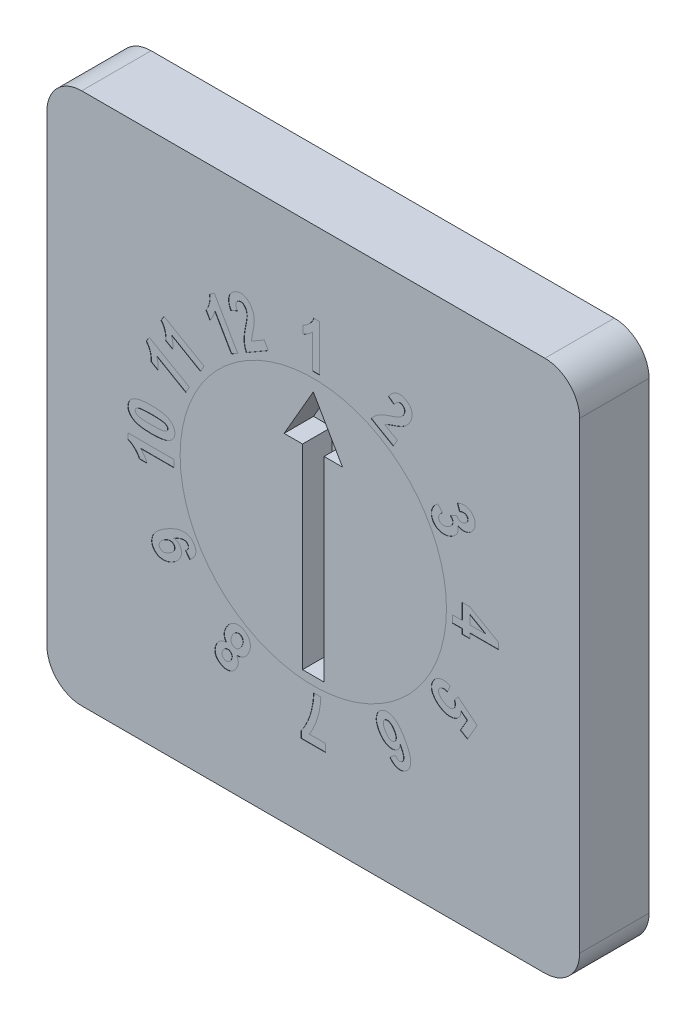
SolidWorks part; units mm, degrees
ref_plane "Front Plane" through (0, 0, 0) normal (0, 0, 1) x (1, 0, 0)
ref_plane "Top Plane" through (0, 0, 0) normal (0, 1, 0) x (1, 0, 0)
ref_plane "Right Plane" through (0, 0, 0) normal (1, 0, 0) x (0, 0, -1)
sketch "Sketch1" plane through (0, 0, 0) normal (0, 0, 1) x (1, 0, 0)
  line L1 (-20, 23) -> (20, 23)
  line L2 (-23, 20) -> (-23, -20)
  line L3 (-20, -23) -> (20, -23)
  line L4 (23, 20) -> (23, -20)
  line L5 (-23, 23) -> (23, -23) construction
  line L6 (-23, -23) -> (23, 23) construction
  arc A0 (20, 23) -> (23, 20) centre (20, 20) cw
  arc A1 (-23, -20) -> (-20, -23) centre (-20, -20) ccw
  arc A2 (-20, 23) -> (-23, 20) centre (-20, 20) ccw
  arc A3 (20, -23) -> (23, -20) centre (20, -20) ccw
  point P0 (0, 0)
  dimension "D1" = 3
  dimension "D2" = 46
  dimension "D3" = 46
extrude "Boss-Extrude1" add sketch "Sketch1" along normal blind 5.9944
sketch "Sketch13" plane through (0, 0, 5.9944) normal (0, 0, 1) x (1, 0, 0)
  circle A0 centre (0, 0) radius 11.5
  dimension "D1" = 23
extrude "Cut-Extrude3" cut sketch "Sketch13" against normal through all
sketch "Sketch16" plane through (0, 0, 5.9944) normal (0, 0, 1) x (1, 0, 0)
  line L0 (0, 0) -> (0, 12.009) construction
  line L1 (-2.4052, 12.009) -> (2.4052, 12.009) construction
  line L2 (0, 0) -> (6.0045, 10.4001) construction
  line L3 (3.9215, 11.6027) -> (8.0875, 9.1975) construction
  line L4 (0, 0) -> (10.4001, 6.0045) construction
  line L5 (9.1975, 8.0875) -> (11.6027, 3.9215) construction
  line L6 (0, 0) -> (12.009, 0) construction
  line L7 (12.009, 2.4052) -> (12.009, -2.4052) construction
  line L8 (0, 0) -> (10.4001, -6.0045) construction
  line L9 (11.6027, -3.9215) -> (9.1975, -8.0875) construction
  line L10 (0, 0) -> (6.0045, -10.4001) construction
  line L11 (8.0875, -9.1975) -> (3.9215, -11.6027) construction
  line L12 (0, 0) -> (0, -12.009) construction
  line L13 (2.4052, -12.009) -> (-2.4052, -12.009) construction
  line L14 (0, 0) -> (-6.0045, -10.4001) construction
  line L15 (-3.9215, -11.6027) -> (-8.0875, -9.1975) construction
  line L16 (0, 0) -> (-10.4001, -6.0045) construction
  line L17 (-9.1975, -8.0875) -> (-11.6027, -3.9215) construction
  line L18 (0, 0) -> (-12.009, 0) construction
  line L19 (-12.009, -2.4052) -> (-12.009, 2.4052) construction
  line L20 (0, 0) -> (-10.4001, 6.0045) construction
  line L21 (-11.6027, 3.9215) -> (-9.1975, 8.0875) construction
  line L22 (0, 0) -> (-6.0045, 10.4001) construction
  line L23 (-8.0875, 9.1975) -> (-3.9215, 11.6027) construction
  text T0 "1" font "Arial Narrow" height 4
  text T1 "2" font "Arial Narrow" height 4
  text T2 "3" font "Arial Narrow" height 4
  text T3 "4" font "Arial Narrow" height 4
  text T4 "5"
  text T5 "6"
  text T6 "7"
  text T7 "8"
  text T8 "9"
  text T9 "10"
  text T10 "11"
  text T11 "12"
  point P41 (0, 0)
  dimension "D1" = 12
extrude "MONTHS" cut sketch "Sketch16" against normal blind 0.0254
sketch "Sketch18" plane through (0, 0, 0) normal (0, 0, -1) x (-1, 0, 0)
  line L0 (23, 2.709) -> (23, -2.709)
  line L1 (23, 20) -> (23, -20) construction
  arc A0 (23, 2.709) -> (23, -2.709) centre (26.683, 0) ccw
  dimension "D1" = 9.144
  dimension "D2" = 0.889
extrude "Cut-Extrude4" cut sketch "Sketch18" against normal blind 2.032
sketch "Sketch19" plane through (0, 0, 0) normal (0, 0, -1) x (-1, 0, 0)
  line L0 (0, 24.1164) -> (0, 0) construction
  line L1 (0, 0) -> (-27.8764, 0) construction
  circle A0 centre (-19.9898, 19.9898) radius 2
  circle A1 centre (19.9898, 19.9898) radius 2
  circle A2 centre (-19.9898, -19.9898) radius 2
  circle A3 centre (19.9898, -19.9898) radius 2
  dimension "D1" = 4
  dimension "D2" = 39.9796
  dimension "D3" = 39.9796
extrude "Cut-Extrude5" cut sketch "Sketch19" against normal blind 4
sketch "Sketch20" plane through (0, 0, 0) normal (0, 0, -1) x (-1, 0, 0)
  line L0 (0, 24.5295) -> (0, 0) construction
  line L1 (0, 0) -> (-31.7052, 0) construction
  line L2 (-22.111, -16.8468) -> (-22.111, 16.8468)
  line L3 (-16.8468, 22.111) -> (16.8468, 22.111)
  line L4 (-20, 23) -> (20, 23) construction
  line L5 (-23, -20) -> (-23, 20) construction
  line L6 (-22.111, 16.8468) -> (-19.9898, 16.8468)
  line L7 (-16.8468, 19.9898) -> (-16.8468, 22.111)
  line L8 (16.8468, 19.9898) -> (16.8468, 22.111)
  line L9 (22.111, 16.8468) -> (19.9898, 16.8468)
  line L10 (22.111, -16.8468) -> (22.111, -2.9865)
  line L11 (22.111, -16.8468) -> (19.9898, -16.8468)
  line L12 (16.8468, -19.9898) -> (16.8468, -22.111)
  line L13 (-16.8468, -22.111) -> (16.8468, -22.111)
  line L14 (-16.8468, -19.9898) -> (-16.8468, -22.111)
  line L15 (-22.111, -16.8468) -> (-19.9898, -16.8468)
  line L16 (22.111, 2.9865) -> (22.111, 16.8468)
  arc A0 (-19.9898, 16.8468) -> (-16.8468, 19.9898) centre (-19.9898, 19.9898) ccw
  circle A1 centre (-19.9898, 19.9898) radius 2 construction
  arc A2 (19.9898, 16.8468) -> (16.8468, 19.9898) centre (19.9898, 19.9898) cw
  arc A3 (19.9898, -16.8468) -> (16.8468, -19.9898) centre (19.9898, -19.9898) ccw
  arc A4 (-19.9898, -16.8468) -> (-16.8468, -19.9898) centre (-19.9898, -19.9898) cw
  arc A7 (22.2839, 3.2358) -> (22.2839, -3.2358) centre (26.683, 0) ccw
  arc A8 (22.111, 2.9865) -> (22.111, -2.9865) centre (26.683, 0) ccw
  point P23 (0, 22.111)
  point P32 (22.111, 0)
  point P35 (-22.111, 0)
  dimension "D3" = 1.143
  dimension "D1" = 0.889
  dimension "D2" = 0.889
  dimension "D4" = 0.889
extrude "Cut-Extrude6" cut sketch "Sketch20" against normal blind 0.8128
sketch "Sketch21" plane through (0, 0, 0) normal (0, 0, -1) x (-1, 0, 0)
  line L0 (-22.111, 16.8468) -> (-22.111, 20)
  line L1 (-20, 22.111) -> (-16.8468, 22.111)
  line L2 (-19.9898, 16.8468) -> (-22.111, 16.8468) construction
  line L3 (-16.8468, 22.111) -> (-16.8468, 19.9898) construction
  line L4 (-19.9898, 16.8468) -> (-22.111, 16.8468)
  line L5 (-16.8468, 22.111) -> (-16.8468, 19.9898)
  line L6 (0, 24.199) -> (0, 0) construction
  line L7 (0, 0) -> (-33.5508, 0) construction
  line L8 (16.8468, 22.111) -> (16.8468, 19.9898)
  line L9 (19.9898, 16.8468) -> (22.111, 16.8468)
  line L10 (20, 22.111) -> (16.8468, 22.111)
  line L11 (22.111, 16.8468) -> (22.111, 20)
  line L12 (22.111, -16.8468) -> (22.111, -20)
  line L13 (20, -22.111) -> (16.8468, -22.111)
  line L14 (19.9898, -16.8468) -> (22.111, -16.8468)
  line L15 (16.8468, -22.111) -> (16.8468, -19.9898)
  line L16 (-16.8468, -22.111) -> (-16.8468, -19.9898)
  line L17 (-19.9898, -16.8468) -> (-22.111, -16.8468)
  line L18 (-20, -22.111) -> (-16.8468, -22.111)
  line L19 (-22.111, -16.8468) -> (-22.111, -20)
  arc A0 (-19.9898, 16.8468) -> (-16.8468, 19.9898) centre (-19.9898, 19.9898) ccw construction
  arc A1 (-19.9898, 16.8468) -> (-16.8468, 19.9898) centre (-19.9898, 19.9898) ccw
  arc A2 (-22.111, 20) -> (-20, 22.111) centre (-20, 20) cw
  arc A4 (-20, 23) -> (-23, 20) centre (-20, 20) ccw construction
  arc A5 (22.111, 20) -> (20, 22.111) centre (20, 20) ccw
  arc A6 (19.9898, 16.8468) -> (16.8468, 19.9898) centre (19.9898, 19.9898) cw
  arc A7 (19.9898, -16.8468) -> (16.8468, -19.9898) centre (19.9898, -19.9898) ccw
  arc A8 (22.111, -20) -> (20, -22.111) centre (20, -20) cw
  arc A9 (-22.111, -20) -> (-20, -22.111) centre (-20, -20) ccw
  arc A10 (-19.9898, -16.8468) -> (-16.8468, -19.9898) centre (-19.9898, -19.9898) cw
  dimension "D1" = 0.889
extrude "Cut-Extrude7" cut sketch "Sketch21" against normal blind 0.8128
imported_body "Imported1"
move or copy body "Body-Move/Copy2" bodies to move or copy 121 placed by mates yes parameters "D1"=0, "D2"=0, "D3"=0
imported_body "Imported1_Backing_Plate"
imported_body "Imported1_Ø4x4 NeoMagnet"
move or copy body "Body-Move/Copy4" bodies to move or copy 126 placed by mates yes parameters "D1"=0, "D2"=0, "D3"=0
pattern_circular "CirPattern1" count 4 over 360
